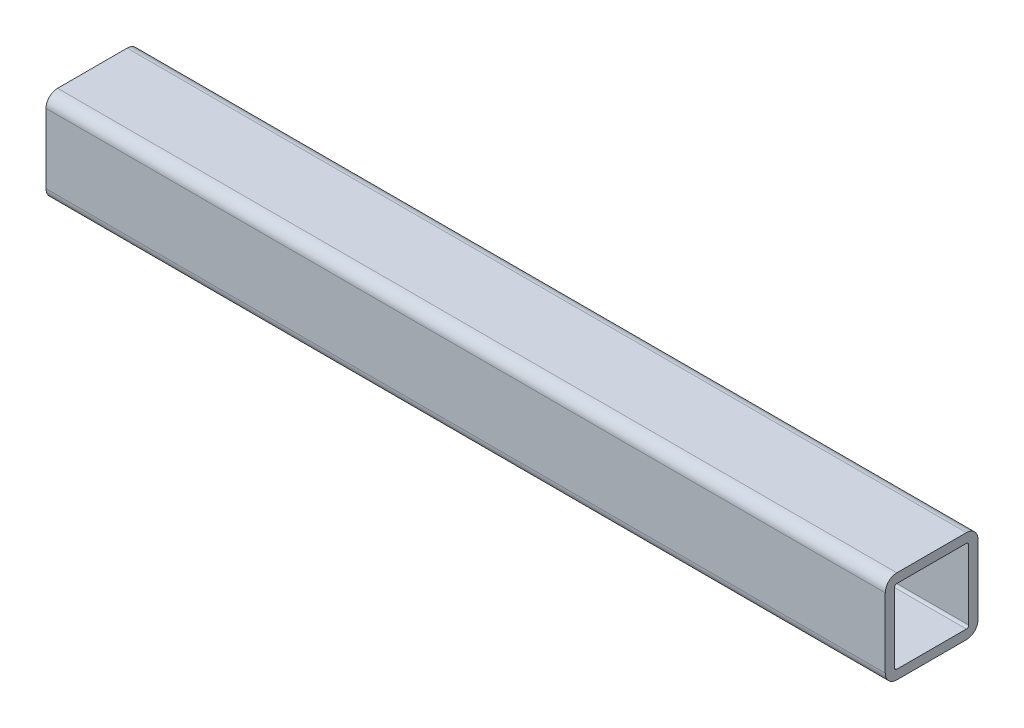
SolidWorks part; units mm, degrees
ref_plane "Ebene vorne" through (0, 0, 0) normal (0, 0, 1) x (1, 0, 0)
ref_plane "Ebene oben" through (0, 0, 0) normal (0, 1, 0) x (1, 0, 0)
ref_plane "Ebene rechts" through (0, 0, 0) normal (1, 0, 0) x (0, 0, -1)
sketch "Skizze1" plane through (0, 0, 0) normal (0, 0, 1) x (1, 0, 0)
  line L0 (0, 0) -> (180.9697, 0)
other "Strukturbauteil1"
ref_plane "Ebene1" through (0, 0, 0) normal (1, 0, 0) x (0, 0, 1)
sketch "Sketch1" plane through (0, 0, 0) normal (1, 0, 0) x (0, 0, 1)
  line L0 (-7.5, -8) -> (7.5, -8)
  line L1 (-8, -7.5) -> (-8, 7.5)
  line L2 (7.5, 8) -> (-7.5, 8)
  line L3 (8, 7.5) -> (8, -7.5)
  line L4 (-7.5, -10) -> (7.5, -10)
  line L5 (-10, -7.5) -> (-10, 7.5)
  line L6 (7.5, 10) -> (-7.5, 10)
  line L7 (10, 7.5) -> (10, -7.5)
  arc A0 (10, 7.5) -> (7.5, 10) centre (7.5, 7.5) ccw
  arc A1 (7.5, -10) -> (10, -7.5) centre (7.5, -7.5) ccw
  arc A2 (-10, -7.5) -> (-7.5, -10) centre (-7.5, -7.5) ccw
  arc A3 (-7.5, 10) -> (-10, 7.5) centre (-7.5, 7.5) ccw
  arc A4 (-7.5, 8) -> (-8, 7.5) centre (-7.5, 7.5) ccw
  arc A5 (8, 7.5) -> (7.5, 8) centre (7.5, 7.5) ccw
  arc A6 (7.5, -8) -> (8, -7.5) centre (7.5, -7.5) ccw
  arc A7 (-8, -7.5) -> (-7.5, -8) centre (-7.5, -7.5) ccw
  point P0 (-10, 0)
  point P1 (10, 0)
  point P2 (0, 10)
  point P3 (0, -10)
  point P4 (0, 0)
  point P5 (-10, -10)
  point P6 (10, -10)
  point P7 (10, 10)
  point P8 (-10, 10)
  point P33 (0, 0)
  dimension "D1" = 2.5
  dimension "Thickness" = 2
  dimension "V_leg" = 20
equation "\"LÄNGE\"=0"
equation "\"BREITE\"=0"
equation "\"HÖHE\"=0"
equation "\"DURCHMESSER\"=0"
equation "\"Stückzahl\"= 1"
